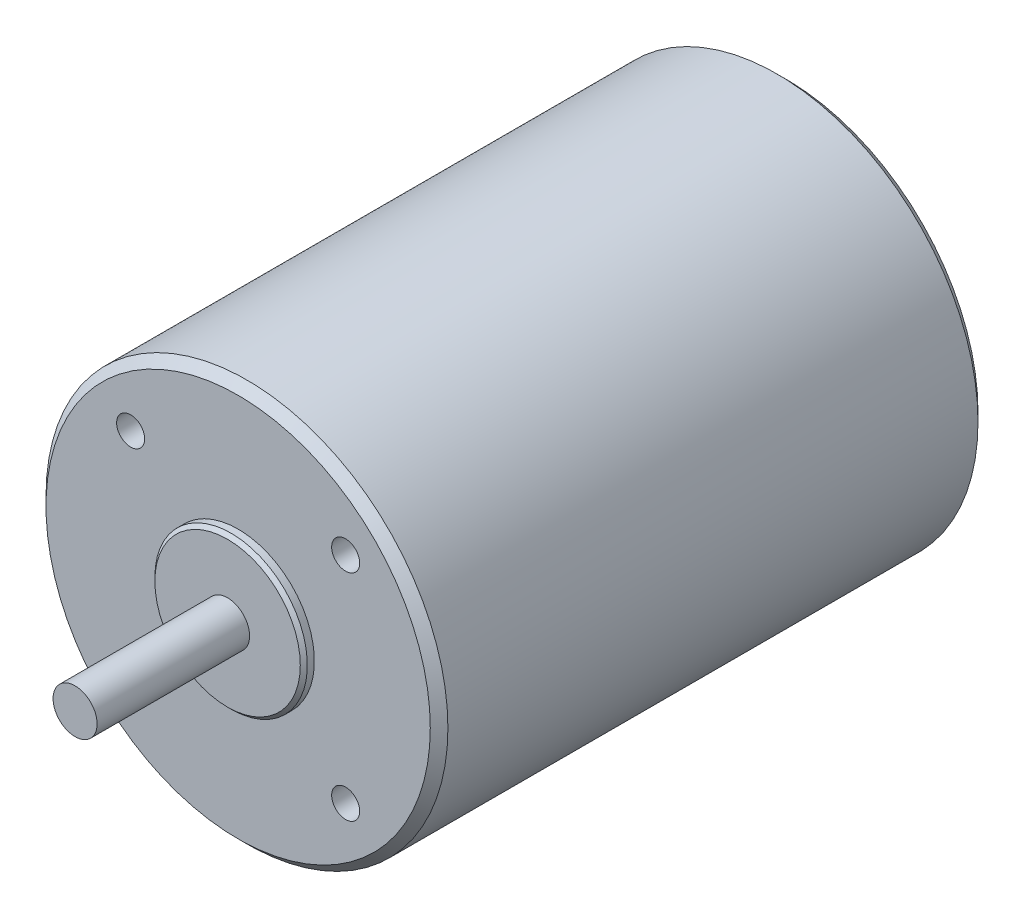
SolidWorks part; units mm, degrees
ref_plane "FRONT" through (0, 0, 0) normal (0, 0, 1) x (1, 0, 0)
ref_plane "TOP" through (0, 0, 0) normal (0, 1, 0) x (1, 0, 0)
ref_plane "RIGHT SIDE" through (0, 0, 0) normal (1, 0, 0) x (0, 0, -1)
sketch "Sketch1" plane through (0, 0, 0) normal (0, 0, 1) x (1, 0, 0)
  circle A0 centre (0, 0) radius 28.956
  dimension "D1" = 57.912
extrude "Base-Extrude" add sketch "Sketch1" along normal blind 78.9178
sketch "Sketch2" plane through (0, 0, 78.9178) normal (0, 0, 1) x (1, 0, 0)
  circle A0 centre (0, 0) radius 3.175
  dimension "D1" = 6.35
extrude "Boss-Extrude1" add sketch "Sketch2" along normal blind 23.495
sketch "Sketch3" plane through (0, 0, 78.9178) normal (0, 0, 1) x (1, 0, 0)
  circle A0 centre (0, 0) radius 10.9855
  dimension "D1" = 21.971
extrude "Boss-Extrude2" add sketch "Sketch3" along normal blind 1.524
chamfer "Chamfer1" distance 0.508 angle 45 1 edges at (10.9855, 0, 80.4418)
chamfer "Chamfer2" distance 1.27 angle 45 2 edges at (28.956, 0, 0) (28.956, 0, 78.9178)
hole_wizard "#10-32 Tapped Hole1" positions "Sketch5" profile "Sketch4" tap size "#10-32" standard "Ansi Inch"
sketch "Sketch5" plane through (0, 0, 78.9178) normal (0, 0, 1) x (1, 0, 0)
  line L2 (0, 0) -> (15.4909, 15.4909) construction
  line L4 (0, 0) -> (33.4453, 0) construction
  circle A0 centre (0, 0) radius 21.9075 construction
  point P0 (15.4909, 15.4909)
  point P36 (15.4909, -15.4909)
  point P37 (-15.4909, -15.4909)
  point P38 (-15.4909, 15.4909)
  dimension "D1" = 43.815
  dimension "D2" = 45
sketch "Sketch4" plane through (15.4909, 15.4909, 78.9178) normal (1, 0, 0) x (0, -1, 0)
  line L0 (0, 0) -> (0, 14.8277)
  line L1 (0, 14.8277) -> (2.0193, 13.6144)
  line L2 (2.0193, 13.6144) -> (2.0193, 0)
  line L5 (2.0193, 0) -> (0, 0)
  line L10 (0, 14.8277) -> (-2.0193, 13.6144) construction
  line L11 (0, -6.35) -> (0, 107.95) construction
  dimension "Tap Drill Dia." = 4.0386
  dimension "Tap Drill Depth" = 13.6144
  dimension "Drill Angle" = 118
